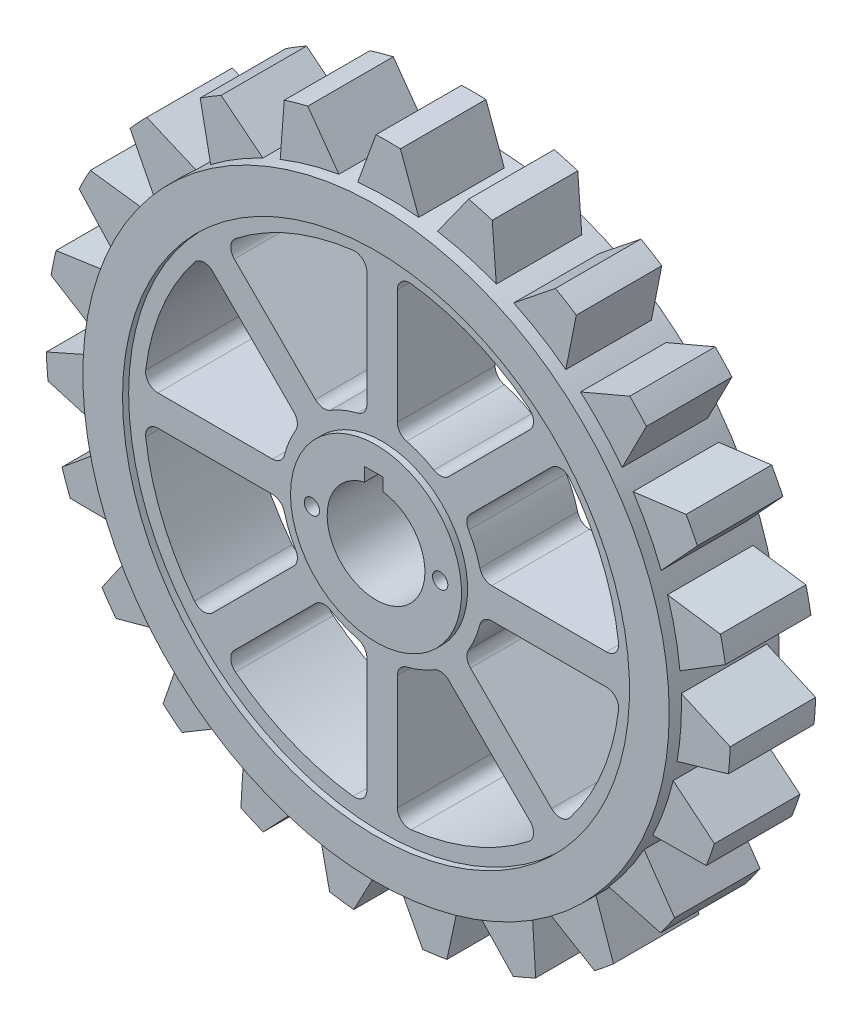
SolidWorks part; units mm, degrees
ref_plane "Front Plane" through (0, 0, 0) normal (0, 0, 1) x (1, 0, 0)
ref_plane "Top Plane" through (0, 0, 0) normal (0, 1, 0) x (1, 0, 0)
ref_plane "Right Plane" through (0, 0, 0) normal (1, 0, 0) x (0, 0, -1)
sketch "Sketch2" plane through (0, 0, 0) normal (0, 0, 1) x (1, 0, 0)
  circle A0 centre (0, 0) radius 48
  dimension "D1" = 96
extrude "Boss-Extrude1" add sketch "Sketch2" along normal mid plane 18
sketch "Sketch3" plane through (0, 0, 9) normal (0, 0, 1) x (1, 0, 0)
  line L0 (0, 0) -> (0, 8) construction
  line L1 (-1.8827, 7.7753) -> (-1.8827, 10)
  line L2 (1.1173, 10) -> (-1.8827, 10)
  line L3 (1.1173, 7.9216) -> (1.1173, 10)
  line L7 (7.675, -2.2572) -> (9.6016, -3.3695)
  line L8 (8.1016, -5.9676) -> (9.6016, -3.3695)
  line L9 (6.3017, -4.9284) -> (8.1016, -5.9676)
  line L13 (-5.7922, -5.5181) -> (-7.7189, -6.6305)
  line L14 (-9.2189, -4.0324) -> (-7.7189, -6.6305)
  line L15 (-7.4189, -2.9932) -> (-9.2189, -4.0324)
  line L19 (0, 0) -> (1.1173, 7.9216) construction
  line L20 (0, 0) -> (7.4189, 2.9932) construction
  line L21 (-6.3017, 4.9284) -> (-8.1016, 5.9676)
  line L22 (-7.675, 2.2572) -> (-9.6016, 3.3695)
  line L23 (-8.1016, 5.9676) -> (-9.6016, 3.3695)
  line L24 (-1.1173, -7.9216) -> (-1.1173, -10)
  line L25 (1.8827, -7.7753) -> (1.8827, -10)
  line L26 (-1.1173, -10) -> (1.8827, -10)
  line L27 (7.4189, 2.9932) -> (9.2189, 4.0324)
  line L28 (5.7922, 5.5181) -> (7.7189, 6.6305)
  line L29 (9.2189, 4.0324) -> (7.7189, 6.6305)
  circle A0 centre (0, 0) radius 8
  circle A1 centre (0, 0) radius 8
  circle A2 centre (0, 0) radius 8
  circle A3 centre (0, 0) radius 8
  circle A4 centre (0, 0) radius 8
  circle A5 centre (0, 0) radius 8
  dimension "D1" = 16
  dimension "D2" = 3
  dimension "D3" = 6
  dimension "10" = 10
  dimension "D4" = 60
  dimension "D5" = 8
extrude "Cut-Extrude1" cut sketch "Sketch3" against normal through all
sketch "Sketch7" plane through (0, 0, -9) normal (0, 0, -1) x (-1, 0, 0)
  circle A0 centre (0, 0) radius 14
  circle A1 centre (0, 0) radius 41.5
  circle A2 centre (0, 0) radius 48 construction
  dimension "D1" = 6.5
  dimension "28" = 28
extrude "Cut-Extrude3" cut sketch "Sketch7" against normal blind 1
mirror "Mirror2" about plane through (0, 0, 0) normal (0, 0, 1) of "Cut-Extrude3"
sketch "Sketch8" plane through (0, 0, -8) normal (0, 0, -1) x (-1, 0, 0)
  line L0 (0, 0) -> (0, 41.5) construction
  line L1 (0, 0) -> (29.3449, 29.3449) construction
  line L2 (2.5, 38.9198) -> (2.5, 16.3095)
  line L4 (25.7527, 29.2882) -> (9.7648, 13.3003)
  circle A0 centre (0, 0) radius 41.5 construction
  circle A1 centre (0, 0) radius 41.5 construction
  circle A2 centre (0, 0) radius 16.5
  circle A3 centre (0, 0) radius 14 construction
  circle A4 centre (0, 0) radius 39
  dimension "D2" = 2.5
  dimension "D1" = 2.5
  dimension "2.5" = 2.5
  dimension "D3" = 2.5
extrude "Cut-Extrude4" cut sketch "Sketch8" against normal through all contours L4 A4 L2 A2
fillet "Fillet1" radius 2 4 edges at (-2.5, 38.9198, 0) (-25.7527, 29.2882, 0) (-9.7648, 13.3003, 0) (-2.5, 16.3095, 0)
pattern_circular "CirPattern2" count 8 over 360 about axis through (0, 0, 0) along (0, 0, 1) of "Fillet1", "Cut-Extrude4"
sketch "Sketch9" plane through (0, 0, 0) normal (0, 0, 1) x (1, 0, 0)
  line L0 (0, 0) -> (0, 48) construction
  line L1 (-2, 55.9643) -> (-4.9936, 47.7395)
  line L2 (2, 55.9643) -> (4.9936, 47.7395)
  circle A0 centre (0, 0) radius 48 construction
  arc A1 (2, 55.9643) -> (-2, 55.9643) centre (0, 0) ccw
  arc A2 (4.9936, 47.7395) -> (-4.9936, 47.7395) centre (0, 0) ccw
  dimension "D1" = 8
  dimension "D2" = 40
  dimension "D3" = 4
extrude "Boss-Extrude2" add sketch "Sketch9" along normal mid plane 14
pattern_circular "CirPattern3" count 23 over 360 about axis through (0, 0, 0) along (0, 0, 1) of "Boss-Extrude2"
sketch "Sketch10" plane through (0, 0, 0) normal (0, 0, 1) x (1, 0, 0)
  line L0 (0, 8) -> (0, -8)
  line L1 (0, -8) -> (0, 0)
  line L2 (0, 0) -> (8, 0)
  line L3 (8, 0) -> (-8, 0)
  arc A0 (-1.8827, 7.7753) -> (1.1173, 7.9216) centre (0, 0) ccw construction
  circle A1 centre (-10.5, 0) radius 1.25
  circle A2 centre (10.5, 0) radius 1.25
  point P8 (0, 0)
  dimension "D1" = 2.5
  dimension "D2" = 2.5
extrude "Cut-Extrude5" cut sketch "Sketch10" against normal through all both and the other way through all contours A1 | A2
